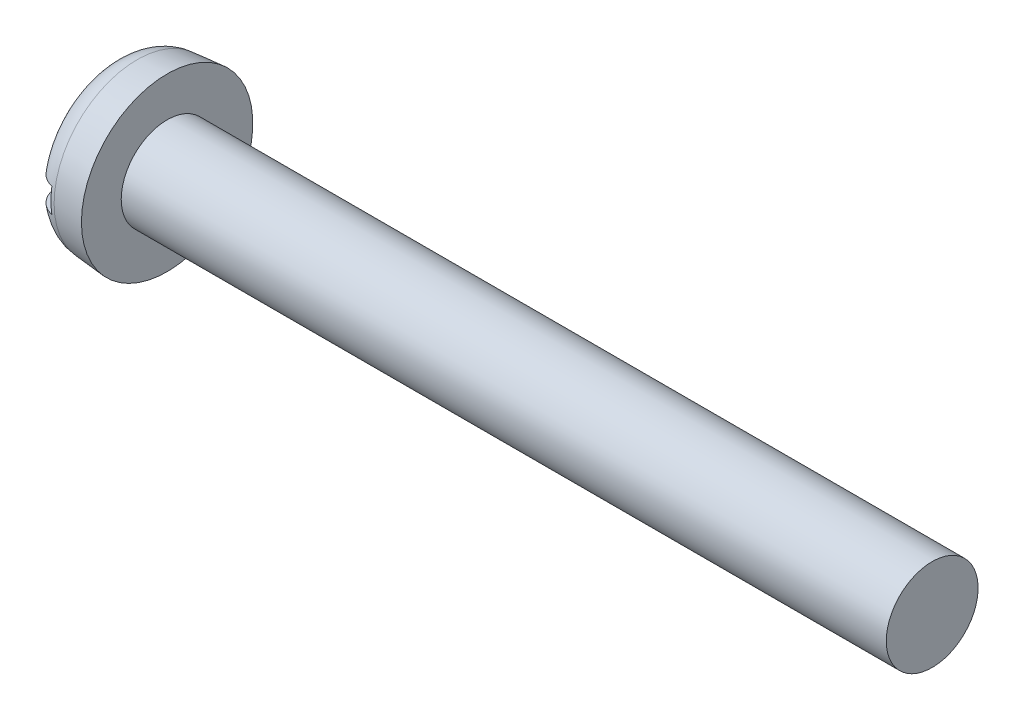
SolidWorks part; units mm, degrees
ref_plane "Plane1" through (0, 0, 0) normal (0, 0, 1) x (1, 0, 0)
ref_plane "Plane2" through (0, 0, 0) normal (0, 1, 0) x (1, 0, 0)
ref_plane "Plane3" through (0, 0, 0) normal (1, 0, 0) x (0, 0, -1)
sketch "BodySke" plane through (0, 0, 0) normal (0, 0, 1) x (1, 0, 0)
  line L0 (1.8, 1.5) -> (1.8, 2.8)
  line L1 (0, 0) -> (0, 2.6425)
  line L2 (-25.4, 0) -> (127, 0) construction
  line L3 (26.8, 0) -> (0, 0)
  line L4 (1.8, 1.5) -> (26.8, 1.5)
  line L5 (26.8, 1.5) -> (26.8, 0)
  line L6 (0, 2.6425) -> (1.8, 2.8)
  line L9 (2.3, 3.0875) -> (2.3, -6.4375) construction
  line L10 (1.8, 6.35) -> (1.8, -3.175) construction
  dimension "Head_ht" = 1.8
  dimension "Diameter" = 3
  dimension "Length" = 25
  dimension "Head_dia" = 5.6
  dimension "Advance" = 0.5
  dimension "Thread_nom" = 25
  dimension "Head_side_angle" = 5
revolve "Base-Revolve" add sketch "BodySke"
fillet "Fillet1" [suppressed] radius 0.1
fillet "Fillet2" radius 0.9 1 edges at (0, 0, 2.6425)
sketch "Sketch2" plane through (0, 0, 0) normal (1, 0, 0) x (0, 0, -1)
  line L0 (2.8, -0.4) -> (-2.8, -0.4)
  line L1 (2.8, -0.4) -> (2.8, 0.4)
  line L2 (-2.8, 0.4) -> (2.8, 0.4)
  line L3 (-2.8, 0.4) -> (-2.8, -0.4)
  dimension "D1" = 5.6
  dimension "D2" = 2.8
  dimension "Slot_width" = 0.8
  dimension "D3" = 0.4
extrude "Slot" cut sketch "Sketch2" along normal blind 0.7
sketch "ThdSchSke" plane through (0, 0, 0) normal (0, 0, 1) x (1, 0, 0)
  line L0 (2.8, -1.2195) -> (2.6036, -1.5)
  line L1 (2.8, -1.2195) -> (2.9964, -1.5)
  line L2 (2.9964, -1.5) -> (2.9964, -1.875)
  line L3 (-3.175, 0) -> (5.1513, 0) construction
  line L5 (2.9964, -1.875) -> (2.6036, -1.875)
  line L6 (2.6036, -1.875) -> (2.6036, -1.5)
  dimension "Thread_minor" = 2.439
  dimension "Diameter" = 3
  dimension "Start" = 2.8
  dimension "SideAngle" = 55
  dimension "VeeAngle" = 70
  dimension "Overcut" = 3.75
revolve "ThreadSchematic" [suppressed] cut sketch "ThdSchSke" angle 360 about L3
pattern_linear "ThdSchPat" [suppressed]
equation "\"D1@Sketch2\" = \"Head_dia@BodySke\""
equation "\"D2@Sketch2\" = \"D1@Sketch2\" / 2"
equation "\"D3@Sketch2\" = \"Slot_width@Sketch2\" / 2"
equation "\"Thread_length@ThreadCosmetic\" = ((sgn( (\"Length@BodySke\" - \"Advance@BodySke\" * 2.0 ) - \"Thread_nom@BodySke\" )-1)*( (\"Length@BodySke\" - \"Advance@BodySke\"  * 2.0) - \"Thread_nom@BodySke\" ))/-2+ \"Thread_"
equation "\"Thread_minor@ThdSchSke\" = \"Thread_minor@ThreadCosmetic\""
equation "\"Diameter@ThdSchSke\" = \"Diameter@BodySke\""
equation "\"Overcut@ThdSchSke\" = \"Diameter@BodySke\" * 1.25"
equation "\"Start@ThdSchSke\" = \"Head_ht@BodySke\" + \"Length@BodySke\" - \"Thread_length@ThreadCosmetic\"  '---Non-countersunk---"
equation "\"Num_threads@ThdSchPat\" = int( \"Thread_length@ThreadCosmetic\" / \"Advance@BodySke\" + 0.999 )  + 1"
equation "\"Advance@ThdSchPat\" = \"Thread_length@ThreadCosmetic\" /  (\"Num_threads@ThdSchPat\" - 1) 'relax it"
